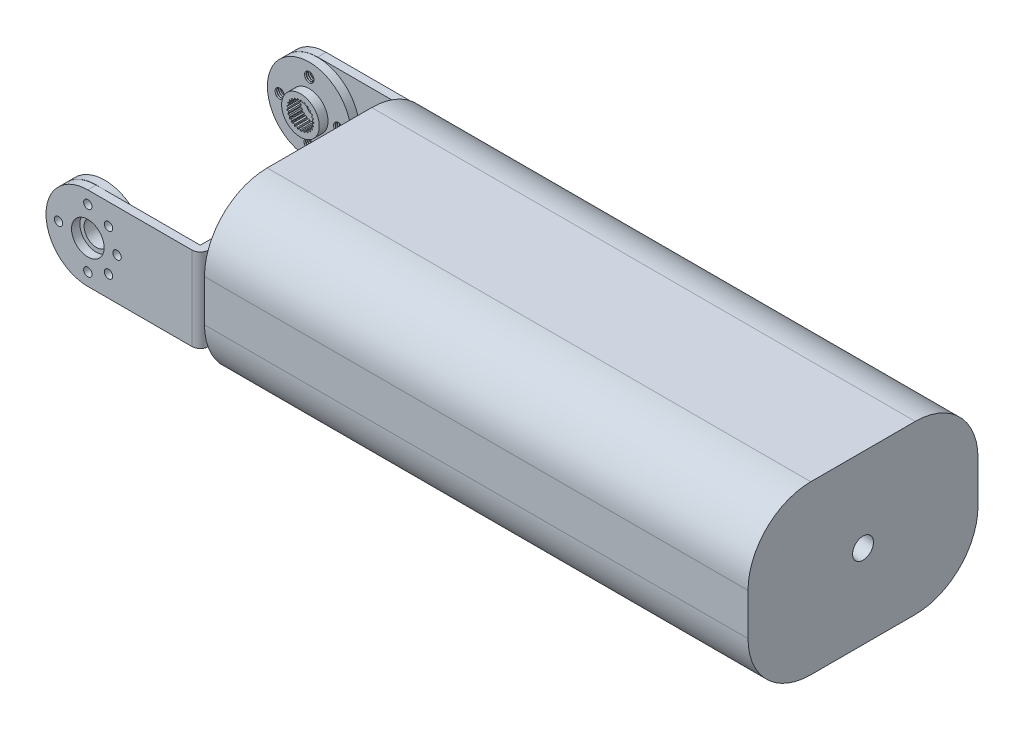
SolidWorks part; units mm, degrees
ref_plane "Front Plane" through (0, 0, 0) normal (0, 0, 1) x (1, 0, 0)
ref_plane "Top Plane" through (0, 0, 0) normal (0, 1, 0) x (1, 0, 0)
ref_plane "Right Plane" through (0, 0, 0) normal (1, 0, 0) x (0, 0, -1)
imported_body "RDS3225 v7.step-1/RDS3225_1.step-1/Wheel_1.step-1-solid1"
imported_body "RDS3225 v7.step-1/RDS3225_1.step-1/Wheel_gear_1.step-1-solid1"
imported_body "RDS3225 v7.step-1/RDS3225_1.step-1/Support_large.step-1-solid1"
sketch "Sketch1" plane through (37.8915, 0, 0) normal (1, 0, 0) x (0, 0, -1)
  line L1 (-26.8, -10) -> (28.2, -10)
  line L2 (-26.8, -10) -> (-26.8, 30)
  line L3 (-26.8, 30) -> (28.2, 30)
  line L4 (28.2, -10) -> (28.2, 30)
  line L5 (-26.8, -10) -> (28.2, 30) construction
  line L6 (-26.8, 30) -> (28.2, -10) construction
  point P0 (0.7, 10)
  point P1 (0.7, 10)
  dimension "D1" = 55
  dimension "D2" = 40
extrude "Boss-Extrude1" add sketch "Sketch1" along normal blind 130
fillet "Fillet1" radius 15 4 edges at (102.8915, 30, 26.8) (102.8915, -10, 26.8) (102.8915, -10, -28.2) (102.8915, 30, -28.2)
ref_point "Point1"
sketch "Sketch2" plane through (37.8915, 0, 0) normal (-1, 0, 0) x (0, 0, 1)
  line L0 (-0.7, 30) -> (-0.7, 20) construction
  line L1 (-13.2, 30) -> (11.8, 30) construction
  line L2 (25.8, 20) -> (-27.2, 20) construction
  circle A0 centre (-0.7, 25) radius 2.5
  dimension "D1" = 5
sketch "Sketch3" plane through (0, 0, -28.2) normal (0, 0, -1) x (-1, 0, 0)
  line L0 (-167.8915, 10) -> (-37.8915, 25)
  line L1 (-37.8915, 30) -> (-37.8915, 20) construction
sweep "Cut-Sweep2" cut profiles "Sketch2" path "Sketch3"
